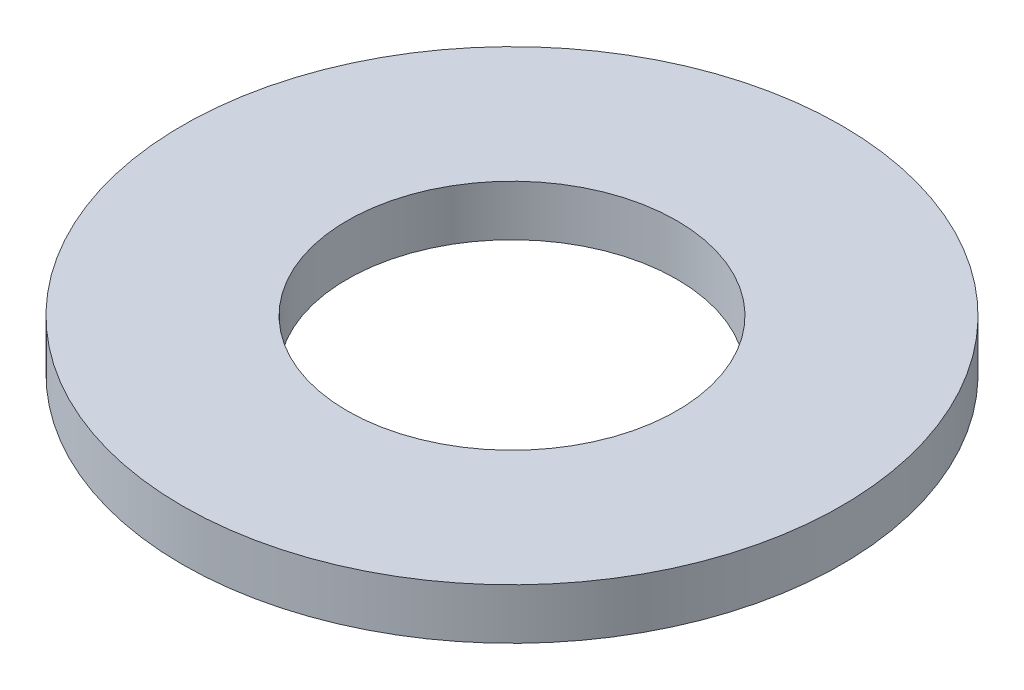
SolidWorks part; units mm, degrees
ref_plane "Front Plane" through (0, 0, 0) normal (0, 0, 1) x (1, 0, 0)
ref_plane "Top Plane" through (0, 0, 0) normal (0, 1, 0) x (1, 0, 0)
ref_plane "Right Plane" through (0, 0, 0) normal (1, 0, 0) x (0, 0, -1)
sketch "Sketch1" plane through (0, 0, 0) normal (0, 1, 0) x (1, 0, 0)
  circle A0 centre (0, 0) radius 3.9624
  dimension "OD" = 7.9248
extrude "Boss-Extrude1" add sketch "Sketch1" along normal blind 0.6096
sketch "Sketch5" plane through (0, 0.6096, 0) normal (0, 1, 0) x (-1, 0, 0)
  circle A0 centre (0, 0) radius 1.9812
  dimension "ID" = 3.9624
extrude "Cut-Extrude1" cut sketch "Sketch5" against normal through all
